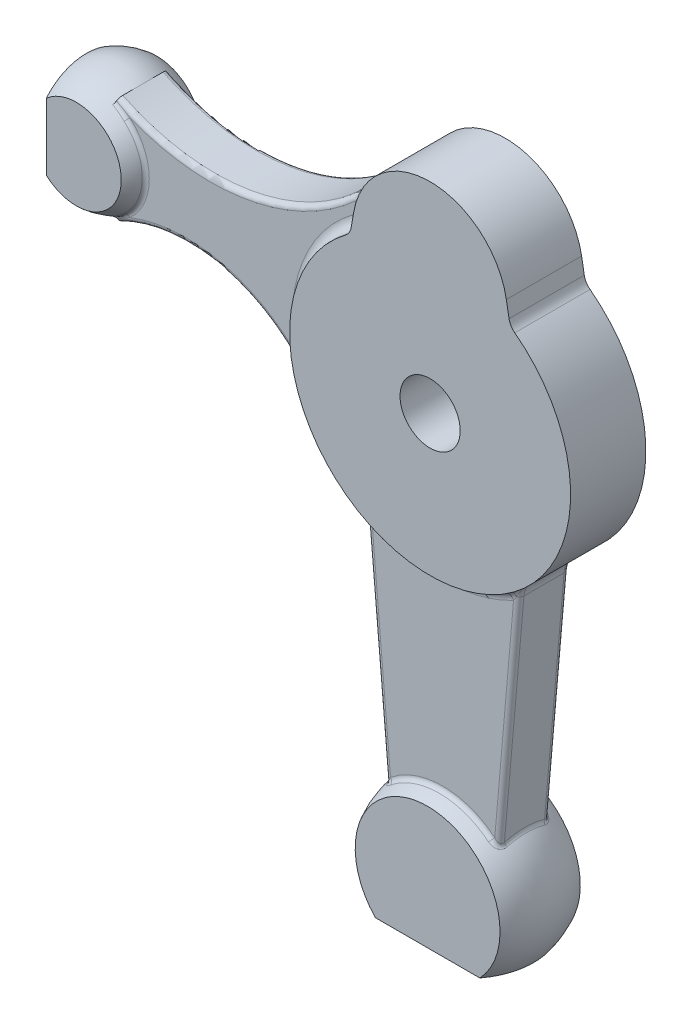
SolidWorks part; units mm, degrees
ref_plane "Face" through (0, 0, 0) normal (0, 0, 1) x (1, 0, 0)
ref_plane "Dessus" through (0, 0, 0) normal (0, 1, 0) x (1, 0, 0)
ref_plane "Droite" through (0, 0, 0) normal (1, 0, 0) x (0, 0, -1)
sketch "Esquisse1" plane through (0, 0, 0) normal (0, 0, 1) x (1, 0, 0)
  line L0 (0, 40) -> (0, -28)
  line L1 (-15.1951, 27.2498) -> (-15.7302, 24.2154)
  line L2 (-53.2606, 0) -> (42.4921, 0) construction
  line L3 (-20, 40) -> (22.9923, 40) construction
  arc A0 (-16.8764, 22.3425) -> (0, -28) centre (0, 0) ccw
  arc A1 (0, 40) -> (-15.1951, 27.2498) centre (0, 24.5705) ccw
  arc A2 (-15.7302, 24.2154) -> (-16.8764, 22.3425) centre (-18.6846, 24.7363) cw
  point P9 (-20, 0)
  dimension "D2" = 28
  dimension "D5" = 3
  dimension "D1" = 20
  dimension "D3" = 10
  dimension "D4" = 40
extrude "Extrusion1" add sketch "Esquisse1" along normal blind 7.5
mirror "Symétrie1" about plane through (0, 40, 7.5) normal (-1, 0, 0) of "Extrusion1"
sketch "Esquisse2" plane through (0, 0, 0) normal (0, 0, 1) x (1, 0, 0)
  line L0 (-76, 10) -> (-58, 10)
  line L1 (-76, 10) -> (-92.0832, 10) construction
  line L2 (-76, 10) -> (-76, -0.3923)
  arc A0 (-76, -0.3923) -> (-58, 10) centre (-70, 10) ccw
  dimension "D3" = 24
  dimension "D1" = 10
  dimension "D2" = 70
  dimension "D4" = 6
revolve "Révolution1" add sketch "Esquisse2" angle 180 about L1
sketch "Esquisse3" plane through (0, 0, 0) normal (0, 0, 1) x (1, 0, 0)
  line L0 (0, -65.5) -> (0, -92)
  line L1 (0, -92) -> (-13.1244, -92)
  line L2 (0, -65.5) -> (0, -45.6672) construction
  arc A0 (0, -65.5) -> (-13.1244, -92) centre (0, -82) ccw
  dimension "D2" = 16.5
  dimension "D1" = 82
  dimension "D3" = 10
revolve "Révolution2" add sketch "Esquisse3" angle 180 about L2
ref_plane "Plan1" through (0, 0, 8) normal (0, 0, 1) x (1, 0, 0)
sketch "Esquisse4" plane through (0, 0, 8) normal (0, 0, 1) x (1, 0, 0)
  line L1 (-91.677, 31.2971) -> (-43.9294, 31.2971)
  line L2 (-91.677, 31.2971) -> (-91.677, -17.2809)
  line L3 (-91.677, -17.2809) -> (-43.9294, -17.2809)
  line L4 (-43.9294, 31.2971) -> (-43.9294, -17.2809)
  line L5 (-33.7571, -56.3093) -> (32.4667, -56.3093)
  line L6 (-33.7571, -56.3093) -> (-33.7571, -102.1885)
  line L7 (-33.7571, -102.1885) -> (32.4667, -102.1885)
  line L8 (32.4667, -56.3093) -> (32.4667, -102.1885)
extrude "Enlèv. mat.-Extru.1" cut sketch "Esquisse4" along normal through all
sketch "Esquisse5" plane through (0, 0, 0) normal (0, 0, 1) x (1, 0, 0)
  line L0 (-64.5915, -0.7121) -> (-70, 10)
  line L1 (-64.7365, 20.7841) -> (-70, 10)
  line L2 (-16.6644, -8.9708) -> (-24.6546, -13.2721)
  line L3 (0, 24.5705) -> (-12.4432, 33.6939)
  line L4 (0, 24.5705) -> (0, 0)
  line L5 (-16.6644, -8.9708) -> (-9.4003, -92)
  line L6 (9.4003, -92) -> (17.4492, 0)
  line L7 (17.4492, 0) -> (0, 0)
  line L8 (-9.4003, -92) -> (9.4003, -92)
  line L9 (-10.4043, -92) -> (10.4043, -92) construction
  line L10 (0, 0) -> (0, -39.0725) construction
  arc A0 (-24.6546, -13.2721) -> (-64.5915, -0.7121) centre (-51.0703, -27.4922) ccw
  arc A1 (-76, -0.3923) -> (-76, 20.3923) centre (-70, 10) ccw construction
  arc A2 (-16.8764, 22.3425) -> (16.8764, 22.3425) centre (0, 0) ccw construction
  arc A3 (-64.7365, 20.7841) -> (-12.4432, 33.6939) centre (-46.3144, 58.5282) ccw
  arc A4 (15.1951, 27.2498) -> (-15.1951, 27.2498) centre (0, 24.5705) ccw construction
  arc A5 (13.1244, -92) -> (-13.1244, -92) centre (0, -82) ccw construction
  point P14 (-70, 10)
  point P16 (0, 24.5705)
  point P25 (-11.325, -70.0002)
  dimension "D1" = 60
  dimension "D2" = 84
  dimension "D3" = 11.325
  dimension "D4" = 5
extrude "Extrusion2" add sketch "Esquisse5" along normal blind 5
fillet "Congé1" radius 5 2 edges at (15.4035, -23.3823, 2.5) (-15.4035, -23.3823, 2.5)
fillet "Congé5" radius 1 9 edges at (-11.3029, -70.253, 2.55) (11.3029, -70.253, 2.55) (-15.7962, -23.7104, 5) (15.7962, -23.7104, 5) (0, -66.2758, 5) (-36.2479, 17.7524, 5) (-42.07, 1.1259, 5) (-13.2203, -48.3365, 5) (13.2203, -48.3365, 5)
fillet "Congé6" radius 1 1 edges at (-59.0915, 10.0736, 5)
fillet "Congé7" radius 2 9 edges at (-15.6614, -23.2104, 4.7775) (15.6614, -23.2104, 4.7775) (-13.8822, 31.3051, 4.754) (-14.957, 28.3596, 5) (-15.4627, 25.7326, 5) (-16.1258, 23.1703, 5) (-26.0929, -10.1568, 4.8028) (0, -28, 5) (-26.6475, 8.5971, 5)
mirror "Symétrie2"
sketch "Esquisse6" plane through (0, 0, 7.5) normal (0, 0, 1) x (1, 0, 0)
  circle A0 centre (0, 0) radius 6
  arc A1 (-16.8764, 22.3425) -> (16.8764, 22.3425) centre (0, 0) ccw construction
  dimension "D1" = 12
extrude "Enlèv. mat.-Extru.2" cut sketch "Esquisse6" against normal through all
fillet "Congé8" radius 0.5 4 edges at (-65.0712, 0.2381, 5.1473) (-64.7417, -0.4147, -2.808) (-65.0712, 0.2381, -5.1473) (-64.7417, -0.4147, 2.808)
